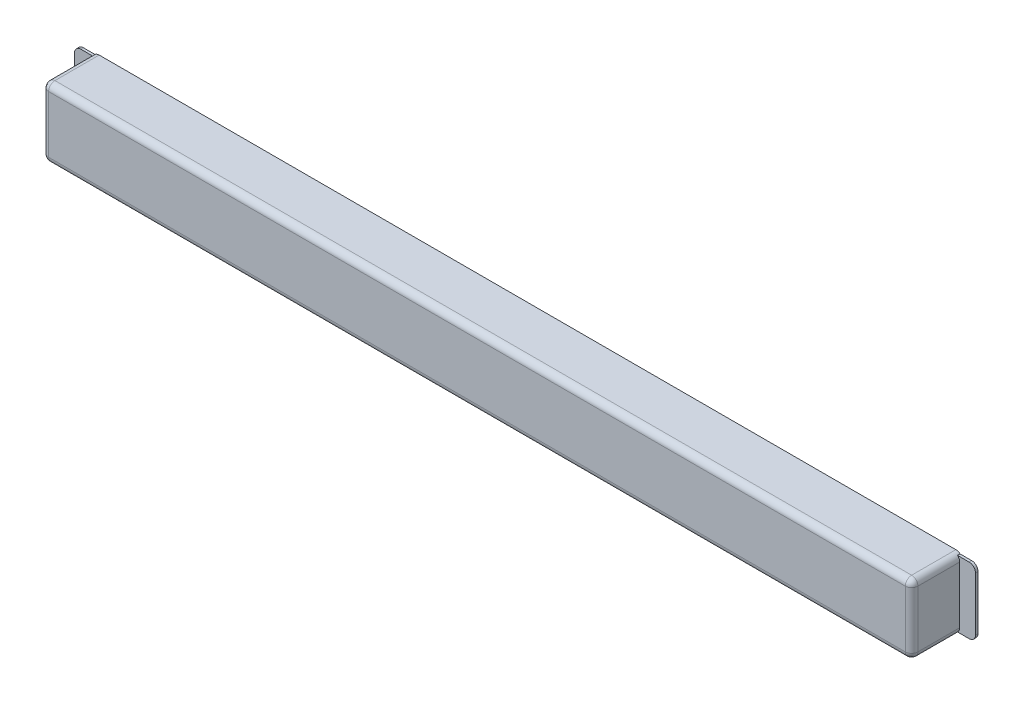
SolidWorks part; units mm, degrees
ref_plane "Front Plane" through (0, 0, 0) normal (0, 0, 1) x (1, 0, 0)
ref_plane "Top Plane" through (0, 0, 0) normal (0, 1, 0) x (1, 0, 0)
ref_plane "Right Plane" through (0, 0, 0) normal (1, 0, 0) x (0, 0, -1)
sketch "Sketch1" plane through (0, 0, 0) normal (0, 0, 1) x (1, 0, 0)
  line L1 (-687.5, 55) -> (687.5, 55)
  line L2 (-687.5, 55) -> (-687.5, -55)
  line L3 (-687.5, -55) -> (687.5, -55)
  line L4 (687.5, 55) -> (687.5, -55)
  line L5 (-687.5, 55) -> (687.5, -55) construction
  line L6 (-687.5, -55) -> (687.5, 55) construction
  point P0 (0, 0)
  dimension "D1" = 1375
  dimension "D2" = 110
extrude "Boss-Extrude1" add sketch "Sketch1" along normal blind 80
sketch "Sketch2" plane through (0, 0, 0) normal (0, 0, -1) x (-1, 0, 0)
  line L0 (-687.5, -55) -> (-687.5, 55) construction
  line L1 (-662.5, 52.5) -> (-712.5, 52.5)
  line L2 (-662.5, 52.5) -> (-662.5, -52.5)
  line L3 (-662.5, -52.5) -> (-712.5, -52.5)
  line L4 (-712.5, 52.5) -> (-712.5, -52.5)
  line L5 (-662.5, 52.5) -> (-712.5, -52.5) construction
  line L6 (-662.5, -52.5) -> (-712.5, 52.5) construction
  point P0 (-687.5, 0)
  dimension "D1" = 105
  dimension "D2" = 50
extrude "Boss-Extrude2" add sketch "Sketch2" against normal blind 4
fillet "Fillet1" radius 10 2 edges at (712.5, -52.5, 2) (712.5, 52.5, 2)
mirror "Mirror1" about plane through (0, 0, 0) normal (1, 0, 0) of "Fillet1", "Boss-Extrude2"
fillet "Fillet2" radius 10 8 edges at (0, -55, 80) (-687.5, 0, 80) (0, 55, 80) (687.5, 0, 80) (687.5, -55, 40) (687.5, 55, 40) (-687.5, -55, 40) (-687.5, 55, 40)
